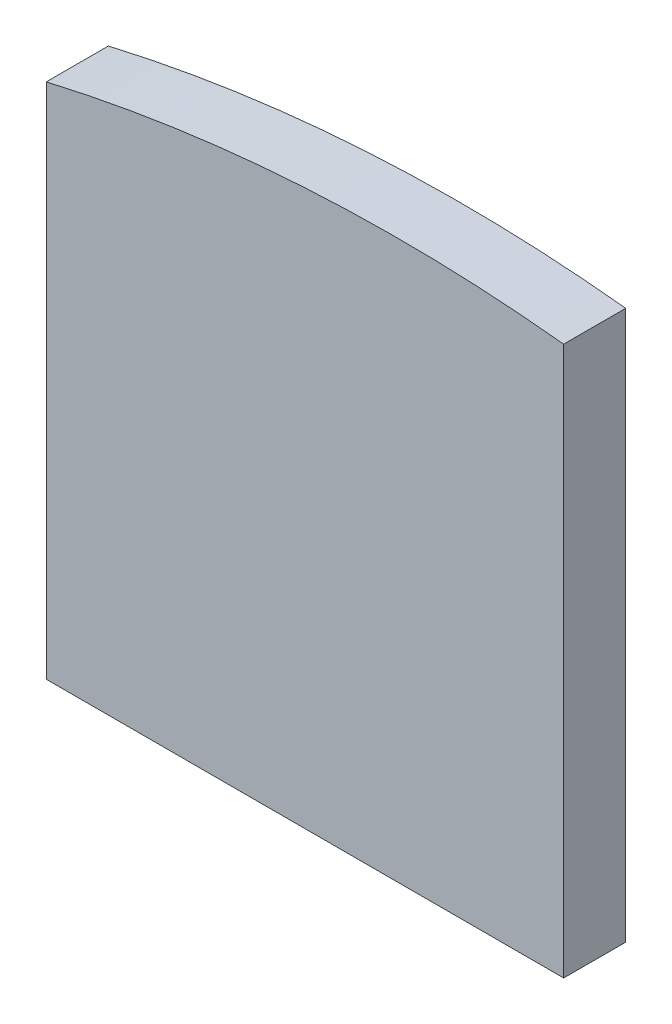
SolidWorks part; units mm, degrees
ref_plane "Front" through (0, 0, 0) normal (0, 0, 1) x (1, 0, 0)
ref_plane "Top" through (0, 0, 0) normal (0, 1, 0) x (1, 0, 0)
ref_plane "Right" through (0, 0, 0) normal (1, 0, 0) x (0, 0, -1)
sketch "Sketch1" plane through (0, 0, 0) normal (0, 0, 1) x (1, 0, 0)
  line L0 (0, 0) -> (0, 300) construction
  line L1 (-68, 292.1917) -> (-68, 192.1917)
  line L2 (-68, 192.1917) -> (32, 192.1917)
  line L3 (32, 192.1917) -> (32, 298.2885)
  arc A0 (-68, 292.1917) -> (32, 298.2885) centre (0, 0) cw
  dimension "D3" = 100
  dimension "D1" = 300
  dimension "D2" = 100
  dimension "D4" = 32
extrude "Extrude1" add sketch "Sketch1" along normal blind 12
